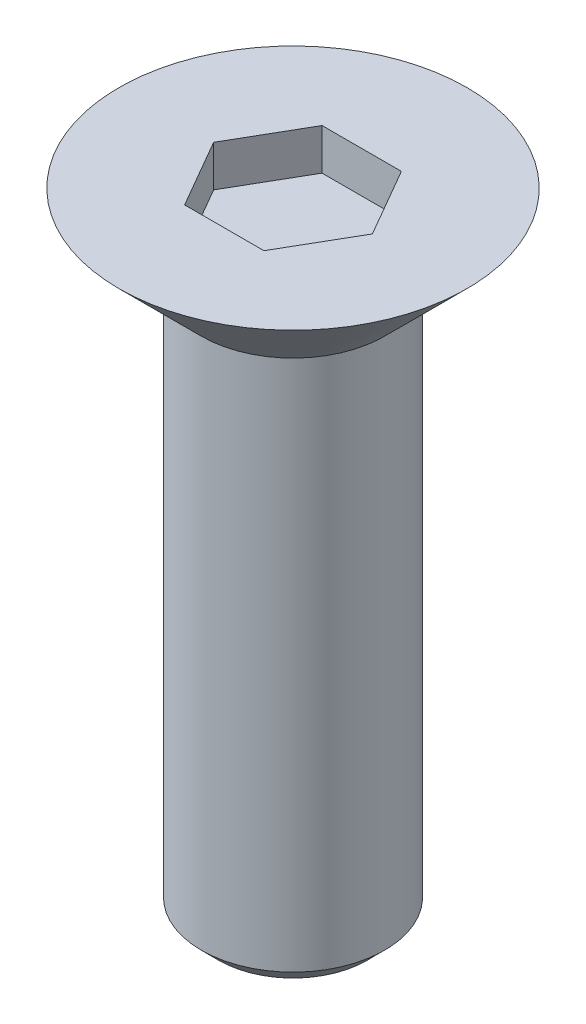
SolidWorks part; units mm, degrees
ref_plane "Front" through (0, 0, 0) normal (0, 0, 1) x (1, 0, 0)
ref_plane "Top" through (0, 0, 0) normal (0, 1, 0) x (1, 0, 0)
ref_plane "Right" through (0, 0, 0) normal (1, 0, 0) x (0, 0, -1)
sketch "Sketch1" plane through (0, 0, 0) normal (0, 1, 0) x (1, 0, 0)
  circle A0 centre (0, 0) radius 3.8
  dimension "D1" = 7.6
extrude "Base-Extrude" add sketch "Sketch1" against normal blind 1.8 draft 45
sketch "Sketch2" plane through (0, -1.8, 0) normal (0, -1, 0) x (1, 0, 0)
  circle A0 centre (0, 0) radius 2
  circle A1 centre (0, 0) radius 2 construction
  dimension "D1" = 4
extrude "Boss-Extrude1" add sketch "Sketch2" along normal blind 11.9888
sketch "Sketch3" plane through (0, 0, 0) normal (0, 1, 0) x (-1, 0, 0)
  line L1 (-1.7321, 0) -> (-0.866, -1.5)
  line L2 (-0.866, -1.5) -> (0.866, -1.5)
  line L3 (0.866, -1.5) -> (1.7321, 0)
  line L4 (1.7321, 0) -> (0.866, 1.5)
  line L5 (0.866, 1.5) -> (-0.866, 1.5)
  line L6 (-0.866, 1.5) -> (-1.7321, 0)
  circle A0 centre (0, 0) radius 1.5 construction
  dimension "D1" = 3
extrude "Cut-Extrude1" cut sketch "Sketch3" against normal blind 0.9
chamfer "Chamfer2" distance 0.381 angle 45 1 edges at (0, -13.7888, -2)
